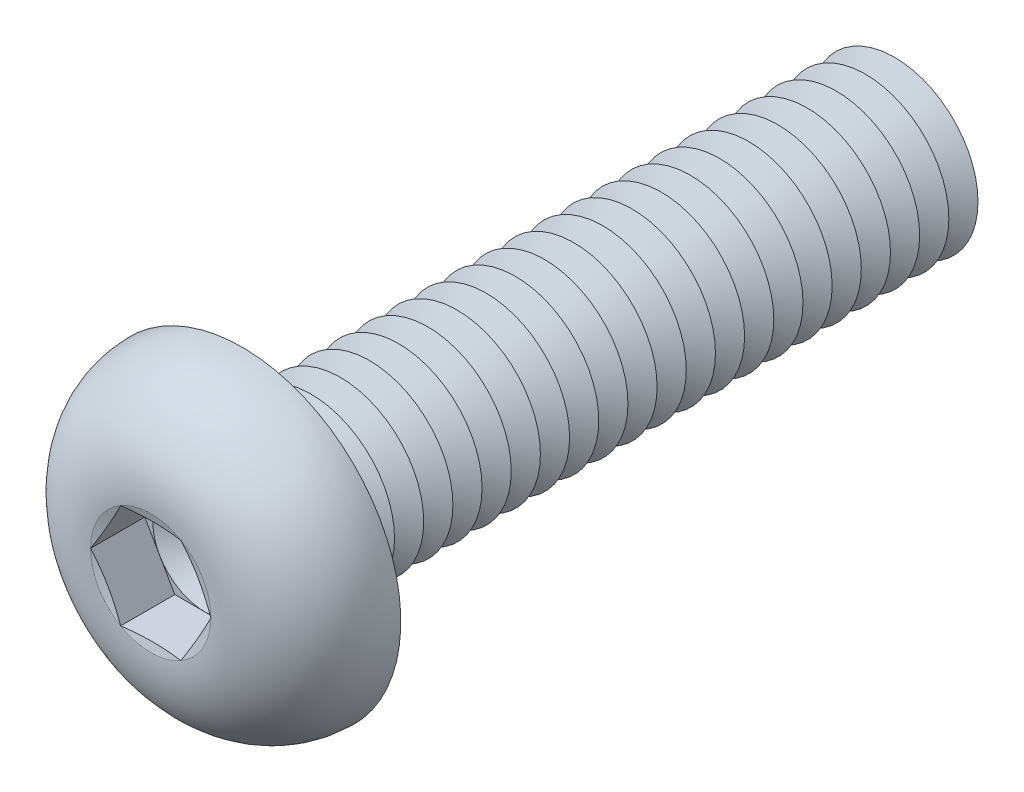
SolidWorks part; units mm, degrees
ref_plane "Front Plane" through (0, 0, 0) normal (0, 0, 1) x (1, 0, 0)
ref_plane "Top Plane" through (0, 0, 0) normal (0, 1, 0) x (1, 0, 0)
ref_plane "Right Plane" through (0, 0, 0) normal (1, 0, 0) x (0, 0, -1)
sketch "Sketch1" plane through (0, 0, 0) normal (1, 0, 0) x (0, 0, -1)
  line L0 (0, 2) -> (0, 3.8)
  line L3 (0, 2) -> (16, 2)
  line L4 (16, 2) -> (16, 0)
  line L5 (16, 0) -> (-2.2, 0) construction
  line L6 (-2.2, 0) -> (16, 0)
  line L7 (-2.2, 1.4434) -> (-2.2, 0.7217) construction
  line L8 (-2.2, 0.7217) -> (-2.2, 0)
  line L9 (-2.2, 1.4434) -> (-2.0066, 0.7217)
  line L10 (-2.0066, 0.7217) -> (-2.2, 0.7217)
  line L11 (16, 0) -> (22.7481, 0) construction
  line L12 (0, 3.8) -> (-2.2, 3.8) construction
  arc A1 (0, 3.8) -> (-2.2, 1.4434) centre (0, 1.5948) ccw
  point P8 (16, 1)
  dimension "D1" = 7.6
  dimension "D2" = 4
  dimension "D3" = 2.2
  dimension "D4" = 2.8868
  dimension "D5" = 16
  dimension "D6" = 15
revolve "Revolve1" add sketch "Sketch1" angle 360 about L5
fillet "Fillet1" radius 0.35 1 edges at (-2, 0, 0)
sketch "Sketch2" plane through (0, 0, 0) normal (1, 0, 0) x (0, 0, -1)
  line L0 (15.65, 2) -> (16.35, 2)
  line L1 (16, 2) -> (0.35, 2) construction
  line L2 (16.35, 2) -> (16, 1.3938)
  line L3 (16, -2) -> (16, 2) construction
  line L4 (16, 1.3938) -> (15.65, 2)
  dimension "D1" = 0.7
revolve "Cut-Revolve1" cut sketch "Sketch2" angle 360 about axis through (0, 0, -16) along (0, 0, -1)
pattern_linear "LPattern1" count 22 spacing 0.7 along (0, 0, 1) of "Cut-Revolve1"
sketch "Sketch3" plane through (0, 0, 2.2) normal (0, 0, 1) x (1, 0, 0)
  line L7 (0.7217, 1.25) -> (-0.7217, 1.25)
  line L8 (-0.7217, 1.25) -> (-1.4434, 0)
  line L9 (-1.4434, 0) -> (-0.7217, -1.25)
  line L10 (-0.7217, -1.25) -> (0.7217, -1.25)
  line L11 (0.7217, -1.25) -> (1.4434, 0)
  line L12 (1.4434, 0) -> (0.7217, 1.25)
  circle A0 centre (0, 0) radius 1.25 construction
  circle A3 centre (0, 0) radius 1.4434 construction
extrude "Cut-Extrude1" cut sketch "Sketch3" against normal blind 1.3
sketch "Sketch4" plane through (0, 0, 0.9) normal (0, 0, 1) x (1, 0, 0)
  line L1 (0.7217, 1.25) -> (-0.7217, 1.25) construction
  circle A0 centre (0, 0) radius 1.25
extrude "Cut-Extrude2" cut sketch "Sketch4" against normal through all draft 60
